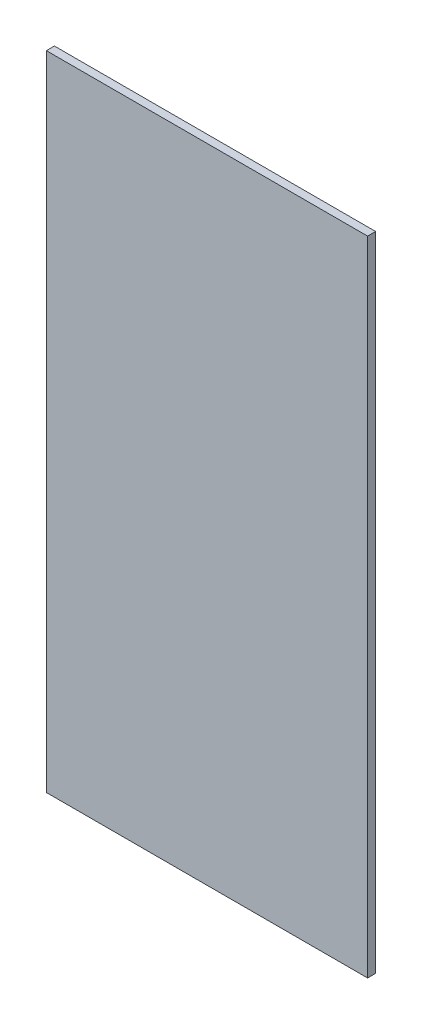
SolidWorks part; units mm, degrees
other "<hingep2>-<Split Line1>"
other "<hingep2>-<Split Line1>"
ref_plane "Plane1" through (0, 0, 0) normal (0, 0, 1) x (1, 0, 0)
ref_plane "Plane2" through (0, 0, 0) normal (0, 1, 0) x (1, 0, 0)
ref_plane "Plane3" through (0, 0, 0) normal (1, 0, 0) x (0, 0, -1)
imported_body "Imported1"
inserted part "hingep2"
move or copy body "Body-Move/Copy2" placed by mates yes
other "Distance1" parameters "D1"=100
inserted part "hingep25"
move or copy body "Body-Move/Copy6" placed by mates yes
other "Distance4" parameters "D1"=100
